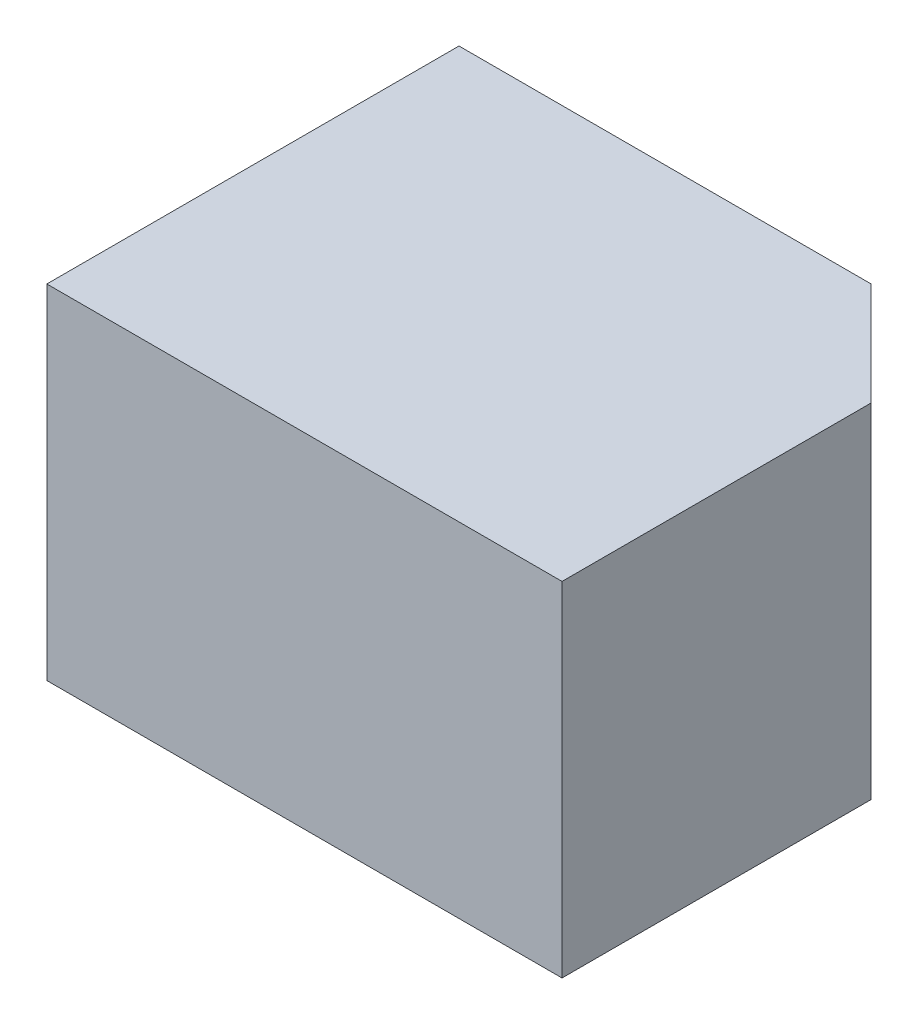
SolidWorks part; units mm, degrees
ref_plane "Front Plane" through (0, 0, 0) normal (0, 0, 1) x (1, 0, 0)
ref_plane "Top Plane" through (0, 0, 0) normal (0, 1, 0) x (1, 0, 0)
ref_plane "Right Plane" through (0, 0, 0) normal (1, 0, 0) x (0, 0, -1)
sketch "Sketch1" plane through (0, 0, 0) normal (0, 1, 0) x (1, 0, 0)
  line L0 (1.5762, 3.539) -> (3.0762, 2.039)
  line L1 (1.5762, 3.539) -> (-4.4238, 3.539)
  line L2 (3.0762, 2.039) -> (3.0762, -2.461)
  line L3 (3.0762, -2.461) -> (-4.4238, -2.461)
  line L4 (-4.4238, 3.539) -> (-4.4238, -2.461)
  line L5 (4.8418, 2.6935) -> (-4.4238, -2.461) construction
  line L6 (3.0762, -2.461) -> (-4.4238, 3.539) construction
  point P0 (0, 0)
  dimension "D1" = 6
  dimension "D2" = 7.5
  dimension "D3" = 45
  dimension "D4" = 1.5
extrude "Boss-Extrude1" add sketch "Sketch1" along normal blind 5
sketch "Sketch2" plane through (0, 0, 0) normal (0, -1, 0) x (1, 0, 0)
  line L0 (1.5762, -3.539) -> (-4.4238, -3.539) construction
  line L1 (-4.4238, -3.539) -> (-4.4238, 2.461) construction
  circle A0 centre (-1.1738, -0.539) radius 1.25
  dimension "D1" = 2.5
  dimension "D2" = 3.25
  dimension "D3" = 3
extrude "Cut-Extrude1" cut sketch "Sketch2" against normal offset from surface (4 mm away) 1
sketch "Sketch4" plane through (0, 0, 0) normal (0, -1, 0) x (1, 0, 0)
  line L1 (1.8262, 1.461) -> (-3.1738, 1.461) construction
  line L2 (1.8262, 1.461) -> (1.8262, -2.539) construction
  line L3 (1.8262, -2.539) -> (-3.1738, -2.539) construction
  line L4 (-3.1738, 1.461) -> (-3.1738, -2.539) construction
  circle A0 centre (-3.1738, 1.461) radius 0.795
  circle A1 centre (1.8262, 1.461) radius 0.795
  circle A2 centre (1.8262, -2.539) radius 0.795
  circle A3 centre (-3.1738, -2.539) radius 0.795
  point P0 (-1.1738, -0.539)
  dimension "D4" = 1.59
  dimension "D1" = 2
  dimension "D2" = 3
  dimension "D3" = 4
  dimension "D5" = 2
extrude "Cut-Extrude2" cut sketch "Sketch4" against normal blind 0.79
